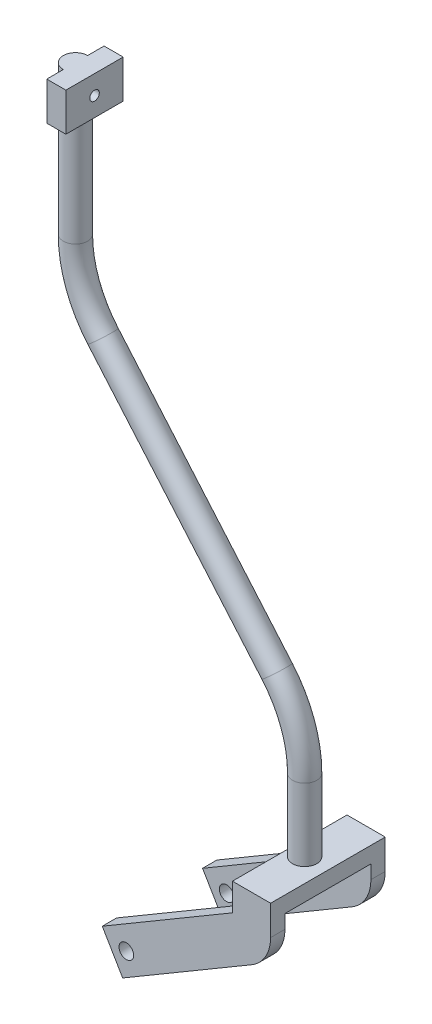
SolidWorks part; units mm, degrees
ref_plane "XY" through (0, 0, 0) normal (0, 0, 1) x (1, 0, 0)
ref_plane "XZ" through (0, 0, 0) normal (0, 1, 0) x (1, 0, 0)
ref_plane "YZ" through (0, 0, 0) normal (1, 0, 0) x (0, 0, -1)
sketch "Sketch1" plane through (0, 0, 0) normal (0, 0, 1) x (1, 0, 0)
  line L0 (0, 0) -> (0, -197.6236)
  line L1 (36.6893, -296.8042) -> (268.1107, -566.7958)
  line L2 (304.8, -665.9764) -> (304.8, -762)
  arc A0 (36.6893, -296.8042) -> (0, -197.6236) centre (152.4, -197.6236) cw
  arc A1 (304.8, -665.9764) -> (268.1107, -566.7958) centre (152.4, -665.9764) ccw
  point P7 (0, -254)
  point P10 (304.8, -609.6)
  dimension "D5" = 152.4
  dimension "D1" = 254
  dimension "D2" = 609.6
  dimension "D3" = 152.4
  dimension "D4" = 304.8
sketch "Sketch2" plane through (0, 0, 0) normal (0, 1, 0) x (1, 0, 0)
  circle A0 centre (0, 0) radius 16.1322
  dimension "D1" = 32.2644
sweep "Base-Sweep" add profiles "Sketch2" path "Sketch1"
sketch "Sketch3" plane through (0, -762, 0) normal (0, -1, 0) x (1, 0, 0)
  line L1 (335.6991, 76.2) -> (284.8991, 76.2)
  line L2 (335.6991, 76.2) -> (335.6991, -76.2)
  line L3 (335.6991, -76.2) -> (284.8991, -76.2)
  line L4 (284.8991, 76.2) -> (284.8991, -76.2)
  circle A0 centre (304.8, 0) radius 16.1322 construction
  dimension "D3" = 19.9009
  dimension "D1" = 152.4
  dimension "D2" = 76.2
  dimension "D4" = 50.8
extrude "Boss-Extrude1" add sketch "Sketch3" along normal blind 12.7
sketch "Sketch5" plane through (0, 0, -76.2) normal (0, 0, -1) x (-1, 0, 0)
  line L0 (-335.6991, -774.7) -> (-335.6991, -801.5787)
  line L1 (-310.6793, -845.3511) -> (-139.0176, -946.4533)
  line L2 (-284.8991, -774.7) -> (-284.8991, -798.4719)
  line L3 (-284.8991, -798.4719) -> (-111.8788, -900.3742)
  line L4 (-111.8788, -900.3742) -> (-139.0176, -946.4533)
  line L5 (-335.6991, -774.7) -> (-284.8991, -774.7)
  arc A0 (-310.6793, -845.3511) -> (-335.6991, -801.5787) centre (-284.8991, -801.5787) cw
  circle A1 centre (-143.8694, -913.0742) radius 9.7037
  point P12 (-335.6991, -830.6154)
  dimension "D4" = 50.8
  dimension "D7" = 19.4074
  dimension "D1" = 55.9154
  dimension "D2" = 171.7533
  dimension "D3" = 196.6815
  dimension "D5" = 31.9906
  dimension "D6" = 12.7
extrude "Boss-Extrude3" add sketch "Sketch5" against normal up to vertex
sketch "Sketch6" plane through (335.6991, 0, 0) normal (1, 0, 0) x (0, 0, -1)
  line L0 (-76.2, -801.5787) -> (-76.2, -845.3511) construction
  line L1 (-57.15, -946.4533) -> (57.15, -946.4533)
  line L2 (-57.15, -946.4533) -> (-57.15, -783.4151)
  line L3 (-57.15, -783.4151) -> (57.15, -783.4151)
  line L4 (57.15, -946.4533) -> (57.15, -783.4151)
  line L5 (-76.2, -946.4533) -> (76.2, -946.4533) construction
  line L6 (76.2, -845.3511) -> (76.2, -801.5787) construction
  dimension "D1" = 19.05
  dimension "D2" = 19.05
  dimension "D3" = 21.4151
extrude "Cut-Extrude1" cut sketch "Sketch6" against normal through all
sketch "Sketch7" plane through (0, 0, 0) normal (1, 0, 0) x (0, 0, -1)
  line L1 (-38.1, 0) -> (38.1, 0)
  line L2 (-38.1, 0) -> (-38.1, -50.8)
  line L3 (-38.1, -50.8) -> (38.1, -50.8)
  line L4 (38.1, 0) -> (38.1, -50.8)
  line L5 (0, 50) -> (0, -50) construction
  dimension "D1" = 50.8
  dimension "D2" = 76.2
  dimension "D3" = 38.1
extrude "Boss-Extrude4" add sketch "Sketch7" along normal blind 25.4
sketch "Sketch8" plane through (25.4, 0, 0) normal (1, 0, 0) x (0, 0, -1)
  line L2 (0, 50) -> (0, -50) construction
  line L3 (38.1, 0) -> (-38.1, 0) construction
  circle A0 centre (0, -25.4) radius 6.35
  dimension "D1" = 12.7
  dimension "D2" = 25.4
extrude "Cut-Extrude2" cut sketch "Sketch8" against normal through all
